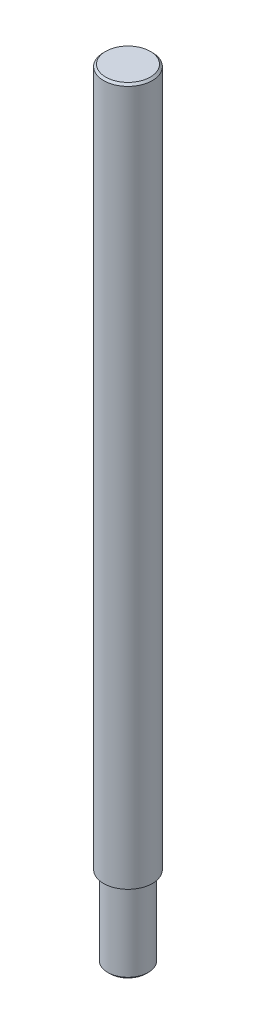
SolidWorks part; units mm, degrees
ref_plane "Front" through (0, 0, 0) normal (0, 0, 1) x (1, 0, 0)
ref_plane "Top" through (0, 0, 0) normal (0, 1, 0) x (1, 0, 0)
ref_plane "Right" through (0, 0, 0) normal (1, 0, 0) x (0, 0, -1)
sketch "Sketch1" plane through (0, 0, 0) normal (0, 1, 0) x (1, 0, 0)
  circle A0 centre (0, 0) radius 2.5
extrude "Extrude1" add sketch "Sketch1" against normal blind 10
sketch "Sketch2" plane through (0, 0, 0) normal (0, 1, 0) x (-1, 0, 0)
  circle A0 centre (0, 0) radius 3
extrude "Extrude2" add sketch "Sketch2" along normal blind 86
chamfer "Chamfer1" distance 0.25 angle 45 1 edges at (0, 86, 3)
chamfer "Chamfer2" distance 0.25 angle 45 1 edges at (0, -10, 2.5)
